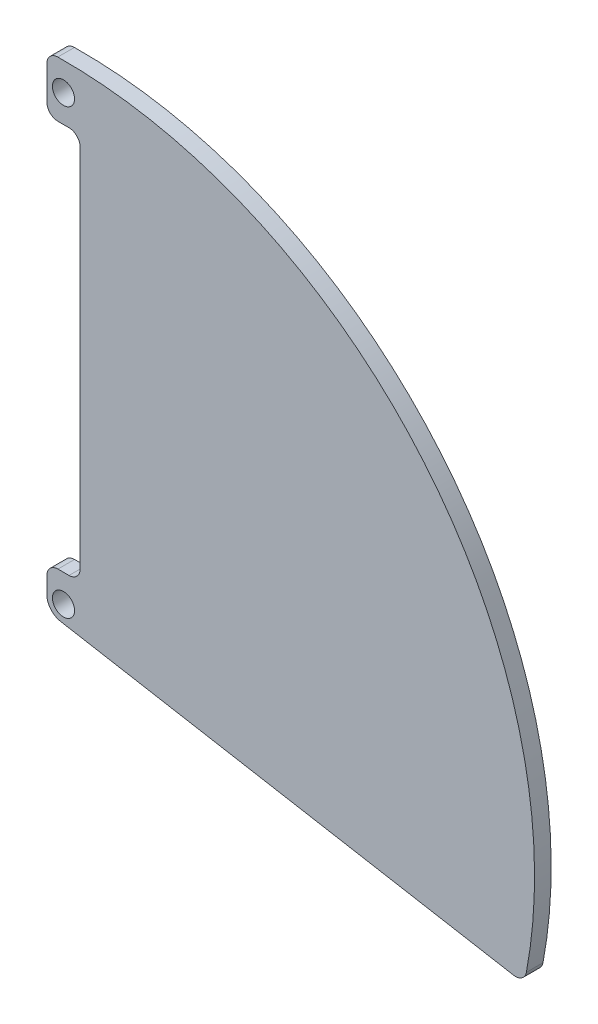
SolidWorks part; units mm, degrees
ref_plane "Front Plane" through (0, 0, 0) normal (0, 0, 1) x (1, 0, 0)
ref_plane "Top Plane" through (0, 0, 0) normal (0, 1, 0) x (1, 0, 0)
ref_plane "Right Plane" through (0, 0, 0) normal (1, 0, 0) x (0, 0, -1)
sketch "Sketch1" plane through (0, 0, 0) normal (0, 0, 1) x (1, 0, 0)
  line L0 (0, 0) -> (0, 400) construction
  line L1 (0, 0) -> (393.9231, -69.4593) construction
  line L2 (-15, 0) -> (-15, 425)
  line L3 (-2.6047, -14.7721) -> (415.9386, -88.5726)
  circle A0 centre (0, 400) radius 10
  circle A1 centre (0, 0) radius 10
  arc A2 (-15, 0) -> (-2.6047, -14.7721) centre (0, 0) ccw
  arc A4 (-15, 425) -> (415.9386, -88.5726) centre (0, 0) cw
  dimension "D2" = 20
  dimension "D3" = 20
  dimension "D4" = 30
  dimension "D1" = 400
  dimension "D5" = 400
  dimension "D6" = 100
  dimension "D7" = 425
  dimension "D8" = 425
extrude "Boss-Extrude1" add sketch "Sketch1" along normal blind 15 contours A4 L2 A2 L3 A1 A0
sketch "Sketch2" plane through (0, 0, 0) normal (0, 0, 1) x (1, 0, 0)
  line L0 (-15, 425) -> (-15, 375)
  line L1 (-15, 0) -> (-15, 425) construction
  line L2 (-15, 375) -> (15, 375)
  line L3 (15, 375) -> (15, 25)
  line L4 (15, 25) -> (-15, 25)
  line L5 (-15, 25) -> (-131.5667, 425)
  line L6 (-131.5667, 425) -> (-15, 425)
  dimension "D1" = 50
  dimension "D2" = 30
  dimension "D3" = 25
extrude "Cut-Extrude1" cut sketch "Sketch2" along normal through all
fillet "Fillet1" radius 10 6 edges at (415.9386, -88.5726, 7.5) (-15, 425, 7.5) (-15, 25, 7.5) (15, 25, 7.5) (15, 375, 7.5) (-15, 375, 7.5)
